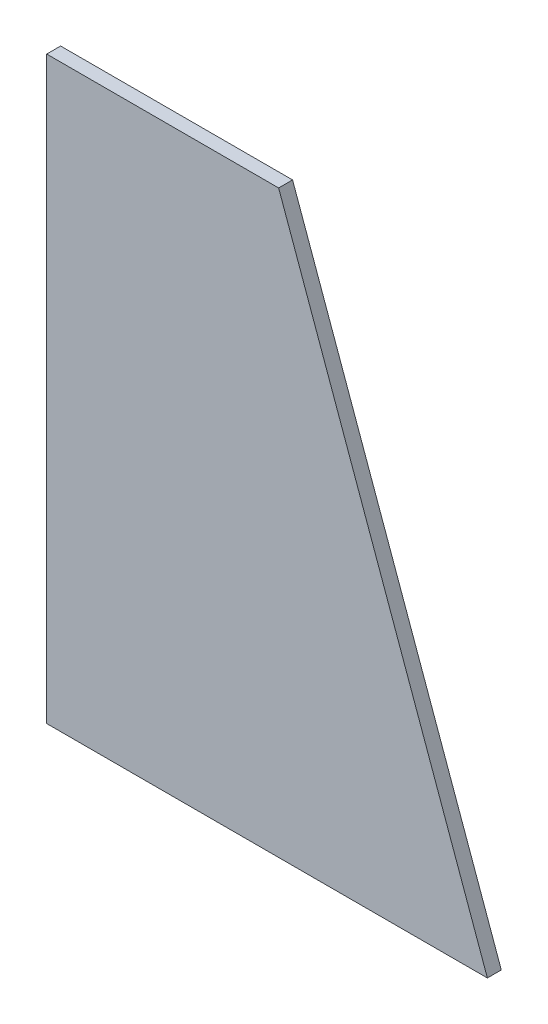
SolidWorks part; units mm, degrees
ref_plane "Front Plane" through (0, 0, 0) normal (0, 0, 1) x (1, 0, 0)
ref_plane "Top Plane" through (0, 0, 0) normal (0, 1, 0) x (1, 0, 0)
ref_plane "Right Plane" through (0, 0, 0) normal (1, 0, 0) x (0, 0, -1)
sketch "Sketch1" plane through (0, 0, 0) normal (0, 0, 1) x (1, 0, 0)
  line L0 (0, 250) -> (0, 0)
  line L1 (0, 0) -> (190, 0)
  line L2 (0, 250) -> (100, 250)
  line L3 (100, 250) -> (190, 0)
  dimension "D3" = 100
  dimension "D1" = 250
  dimension "D2" = 190
extrude "Boss-Extrude1" add sketch "Sketch1" along normal blind 6 contours L0 L1 L3 L2
